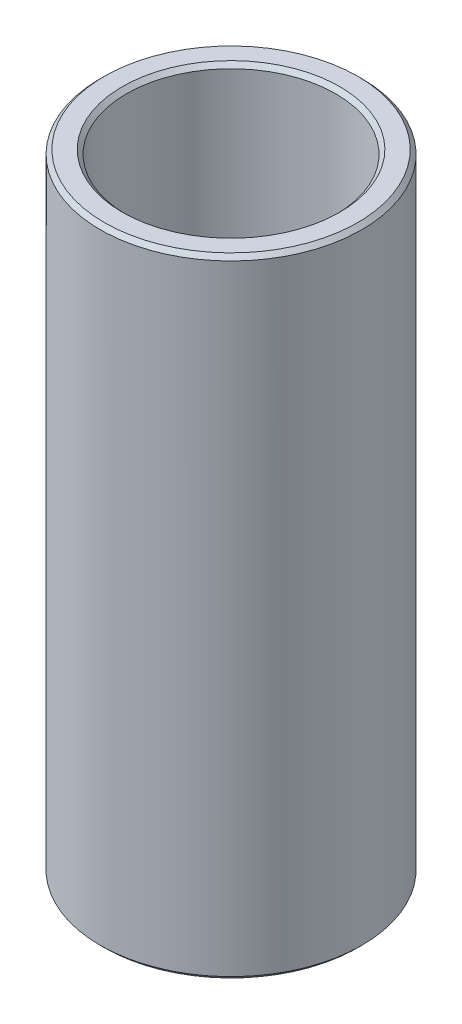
SolidWorks part; units mm, degrees
ref_plane "Front Plane" through (0, 0, 0) normal (0, 0, 1) x (1, 0, 0)
ref_plane "Top Plane" through (0, 0, 0) normal (0, 1, 0) x (1, 0, 0)
ref_plane "Right Plane" through (0, 0, 0) normal (1, 0, 0) x (0, 0, -1)
sketch "Sketch1" plane through (0, 0, 0) normal (0, 1, 0) x (1, 0, 0)
  circle A0 centre (0, 0) radius 7.9375
  circle A1 centre (0, 0) radius 6.35
  dimension "D1" = 15.875
  dimension "D2" = 12.7
extrude "Extrude1" add sketch "Sketch1" along normal blind 38.1
chamfer "Chamfer1" distance 0.25 angle 45 4 edges at (0, 0, 6.35) (0, 0, 7.9375) (0, 38.1, 6.35) (0, 38.1, 7.9375)
